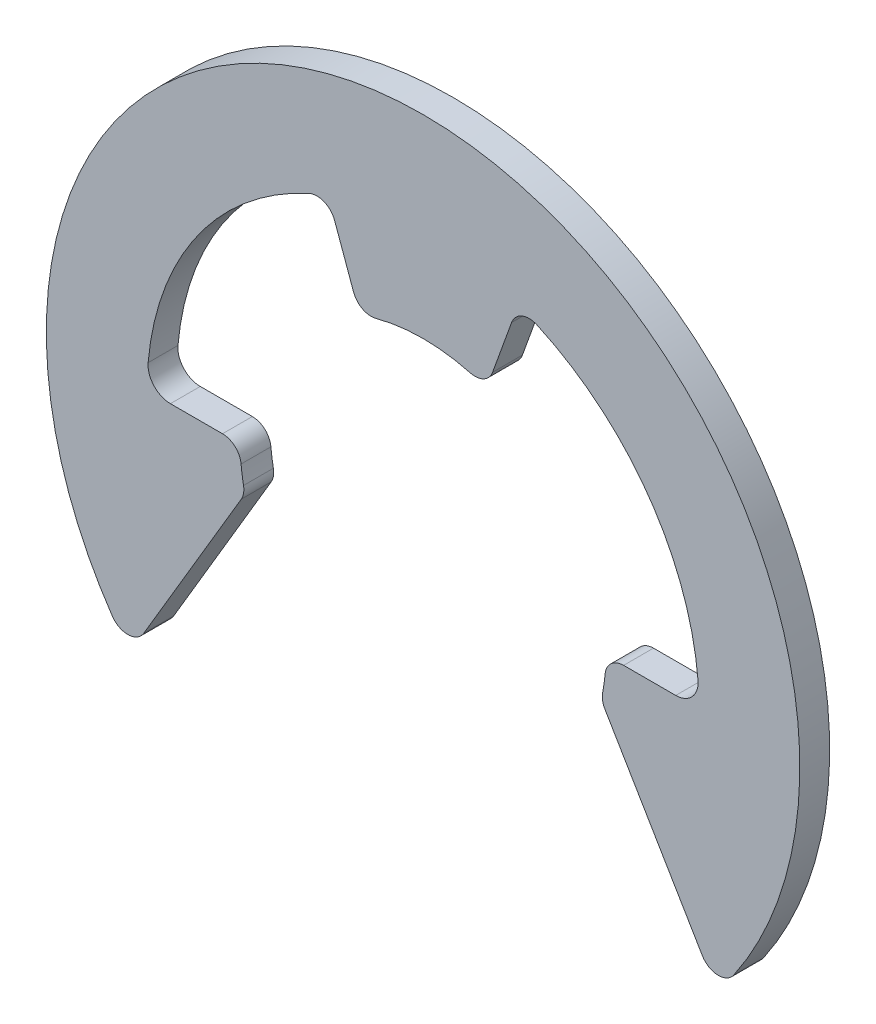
SolidWorks part; units mm, degrees
ref_plane "正面" through (0, 0, 0) normal (0, 0, 1) x (1, 0, 0)
ref_plane "平面" through (0, 0, 0) normal (0, 1, 0) x (1, 0, 0)
ref_plane "右側面" through (0, 0, 0) normal (1, 0, 0) x (0, 0, -1)
ref_plane "平面1" through (0, 0, 0.4) normal (0, 0, 1) x (1, 0, 0)
sketch "ｽｹｯﾁ1" plane through (0, 0, 0.4) normal (0, 0, 1) x (1, 0, 0)
  line L0 (4.7749, -1.1) -> (7.8689, -6.3317)
  line L1 (-7.8689, -6.3317) -> (-4.7749, -1.1)
  line L2 (-4.9, 0) -> (-7.4, 0)
  line L3 (-2.55, 6.9468) -> (-1.7, 4.5957)
  line L4 (1.7, 4.5957) -> (2.55, 6.9468)
  line L5 (7.4, 0) -> (4.9, 0)
  line L6 (0, 0) -> (0, -8.2387) construction
  line L7 (0, 0) -> (0, 7.5087) construction
  arc A0 (7.8689, -6.3317) -> (-7.8689, -6.3317) centre (0, 0) ccw
  arc A1 (-4.7749, -1.1) -> (-4.9, 0) centre (0, 0) cw
  arc A2 (-7.4, 0) -> (-2.55, 6.9468) centre (0, 0) cw
  arc A3 (-1.7, 4.5957) -> (1.7, 4.5957) centre (0, 0) cw
  arc A4 (2.55, 6.9468) -> (7.4, 0) centre (0, 0) cw
  arc A5 (4.9, 0) -> (4.7749, -1.1) centre (0, 0) cw
  dimension "D1" = 10.1
  dimension "D2" = 4.9
  dimension "D3" = 2.7
  dimension "D4" = 61.2
  dimension "D5" = 1.1
  dimension "D6" = 3.4
  dimension "D7" = 5.1
extrude "ﾎﾞｽ - 押し出し1" add sketch "ｽｹｯﾁ1" against normal blind 0.8
fillet "ﾌｨﾚｯﾄ1" radius 0.5 2 edges at (2.55, 6.9468, 0) (-2.55, 6.9468, 0)
fillet "ﾌｨﾚｯﾄ2" radius 0.5 2 edges at (1.7, 4.5957, 0) (-1.7, 4.5957, 0)
fillet "ﾌｨﾚｯﾄ3" radius 0.6 2 edges at (7.4, 0, 0) (-7.4, 0, 0)
fillet "ﾌｨﾚｯﾄ4" radius 0.5 6 edges at (4.9, 0, 0) (4.7749, -1.1, 0) (7.8689, -6.3317, 0) (-7.8689, -6.3317, 0) (-4.7749, -1.1, 0) (-4.9, 0, 0)
